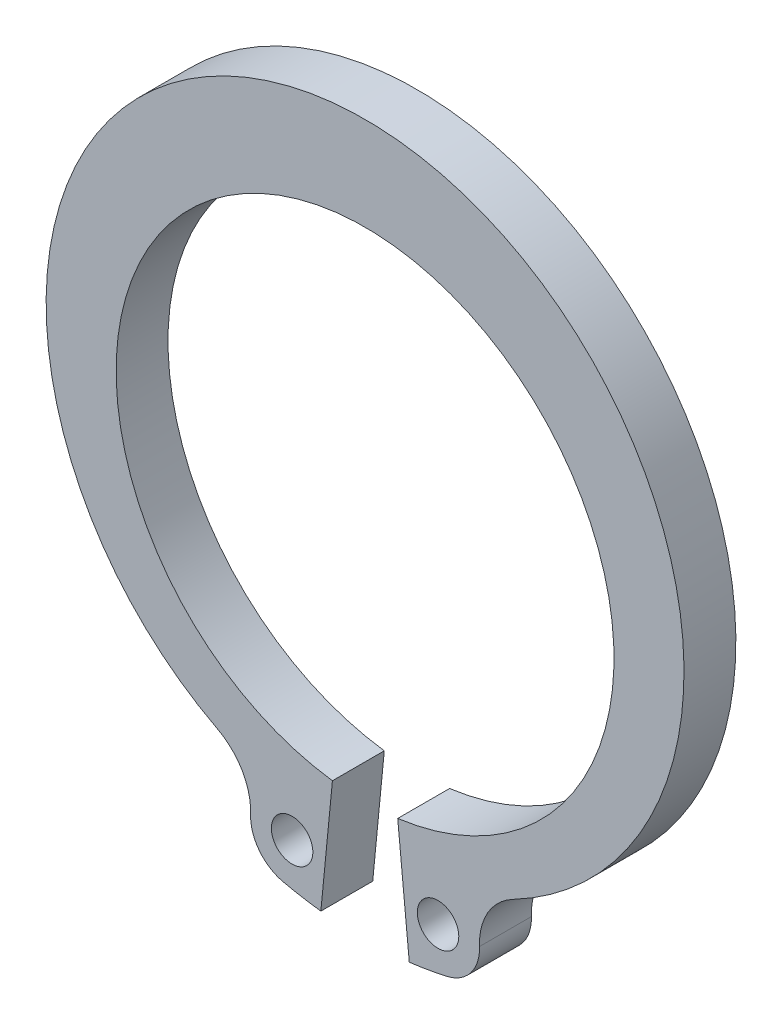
SolidWorks part; units mm, degrees
ref_plane "Face" through (0, 0, 0) normal (0, 0, 1) x (1, 0, 0)
ref_plane "Dessus" through (0, 0, 0) normal (0, 1, 0) x (1, 0, 0)
ref_plane "Droite" through (0, 0, 0) normal (1, 0, 0) x (0, 0, -1)
sketch "Esquisse1" plane through (0, 0, 0) normal (0, 0, 1) x (1, 0, 0)
  line L0 (0, 6.6) -> (0, 4.8) construction
  line L1 (0.6295, -4.7585) -> (0.8524, -7.0477)
  line L2 (-0.6295, -4.7585) -> (-0.8524, -7.0477)
  line L3 (0.16, -4.6472) -> (0.16, -6.9472) construction
  line L4 (-0.16, -4.6472) -> (-0.16, -6.9472) construction
  arc A0 (0.6295, -4.7585) -> (-0.6295, -4.7585) centre (0, 0) ccw
  arc A1 (2.8496, -5) -> (-2.8496, -5) centre (0, 0.45) ccw
  arc A2 (0.8524, -7.0477) -> (1.5857, -6.9197) centre (0, 0) ccw
  circle A3 centre (1.407, -6.1399) radius 0.4
  arc A4 (1.5857, -6.9197) -> (2.2064, -6.1093) centre (1.407, -6.1399) ccw
  arc A5 (2.8496, -5) -> (2.2064, -6.1093) centre (3.4056, -6.0634) ccw
  circle A6 centre (-1.407, -6.1399) radius 0.4
  arc A7 (-2.8496, -5) -> (-2.2064, -6.1093) centre (-3.4056, -6.0634) cw
  arc A8 (-1.5857, -6.9197) -> (-2.2064, -6.1093) centre (-1.407, -6.1399) cw
  arc A9 (-0.8524, -7.0477) -> (-1.5857, -6.9197) centre (0, 0) cw
  arc A10 (0.16, -4.6472) -> (-0.16, -4.6472) centre (0, 0) ccw construction
  circle A11 centre (0, 0) radius 5 construction
  dimension "dgorge" = 9.6
  dimension "D3" = 0.45
  dimension "dtrou" = 0.8
  dimension "D8" = 0.8
  dimension "D9" = 1.2
  dimension "dint" = 9.3
  dimension "dn" = 10
  dimension "b" = 1.8
  dimension "a" = 2.3
  dimension "D5" = 15.07
  dimension "D7" = 0.64
  dimension "D12" = 0.32
  dimension "D13" = 3.944
  dimension "D14" = 5.563
extrude "Base-Extrusion" add sketch "Esquisse1" along normal blind 1
equation "\"D3@Esquisse1\" = \"b@Esquisse1\"/4"
equation "\"D7@Esquisse1\"=\"dtrou@Esquisse1\"*0.8"
equation "\"D8@Esquisse1\" = \"dtrou@Esquisse1\""
equation "\"D9@Esquisse1\" = \"dtrou@Esquisse1\"*1.5"
equation "\"D12@Esquisse1\" = \"dtrou@Esquisse1\"*0.4"
equation "\"D5@Esquisse1\" = 360-(360-\"D13@Esquisse1\")*\"dint@Esquisse1\"/\"dgorge@Esquisse1\""
equation "\"D14@Esquisse1\" = (\"D5@Esquisse1\"-\"D13@Esquisse1\")/2"
